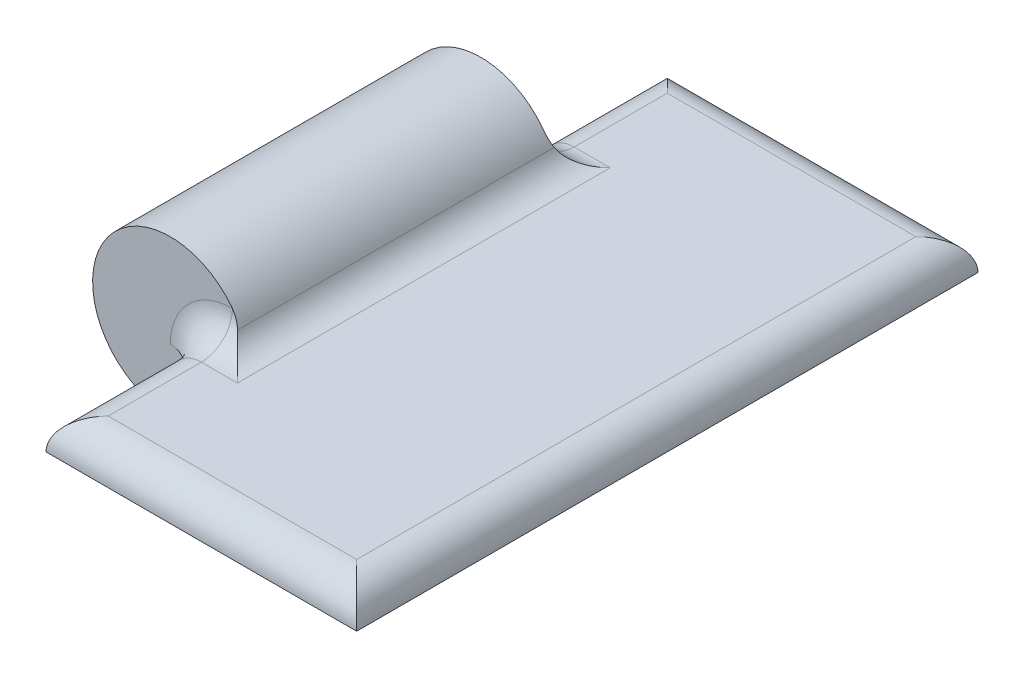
SolidWorks part; units mm, degrees
ref_plane "Front Plane" through (0, 0, 0) normal (0, 0, 1) x (1, 0, 0)
ref_plane "Top Plane" through (0, 0, 0) normal (0, 1, 0) x (1, 0, 0)
ref_plane "Right Plane" through (0, 0, 0) normal (1, 0, 0) x (0, 0, -1)
sketch "Sketch1" plane through (0, 0, 0) normal (0, 0, 1) x (1, 0, 0)
  circle A0 centre (0, 0) radius 5
  dimension "D1" = 10
extrude "Boss-Extrude1" add sketch "Sketch1" along normal blind 20
sketch "Sketch2" plane through (0, 0, 0) normal (0, 1, 0) x (1, 0, 0)
  line L0 (2, 10) -> (2, -30)
  line L1 (2, 10) -> (22, 10)
  line L2 (22, 10) -> (22, -30)
  line L3 (22, -30) -> (2, -30)
  line L4 (5, 0) -> (-5, 0) construction
  line L6 (-5, -20) -> (5, -20) construction
  line L7 (-5, 0) -> (-5, -20) construction
  dimension "D1" = 10
  dimension "D2" = 10
  dimension "D3" = 20
  dimension "D4" = 7
extrude "Boss-Extrude2" add sketch "Sketch2" along normal mid plane 2
fillet "Fillet1" radius 2 8 edges at (4.899, 1, 10) (3.4495, 1, 0) (2, 1, -5) (12, 1, -10) (22, 1, 10) (12, 1, 30) (2, 1, 25) (3.4495, 1, 20)
